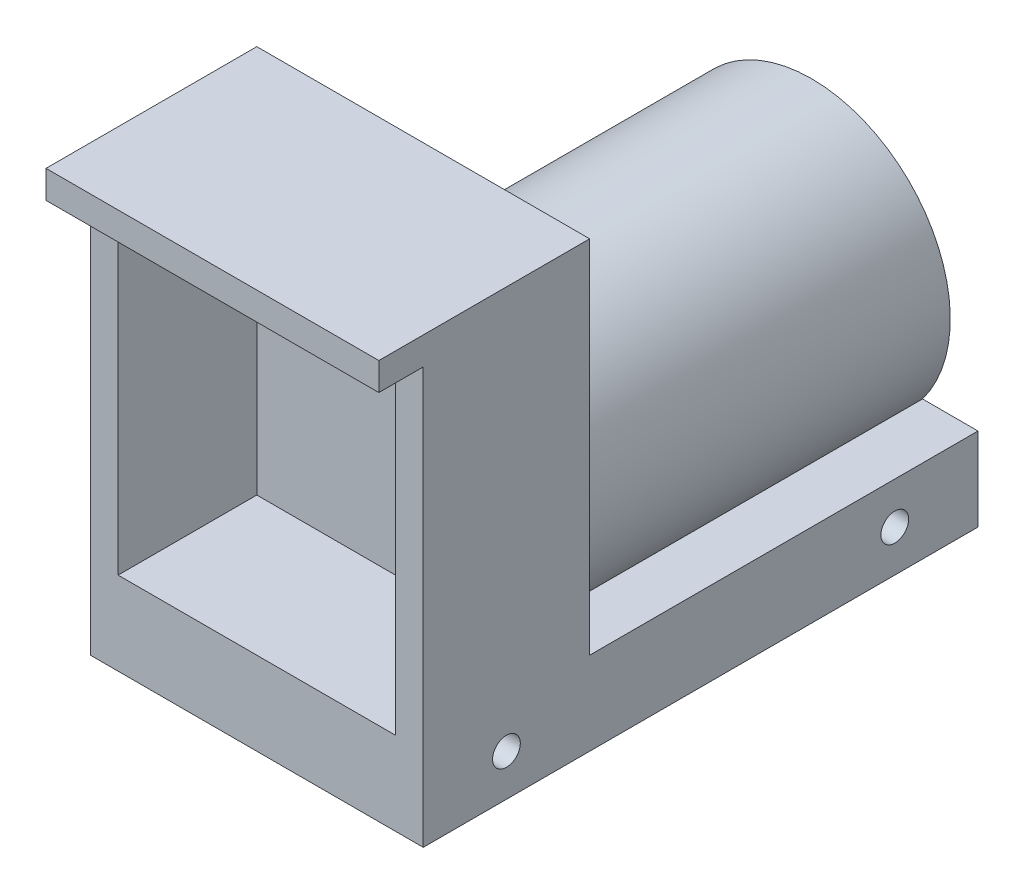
SolidWorks part; units mm, degrees
ref_plane "Front Plane" through (0, 0, 0) normal (0, 0, 1) x (1, 0, 0)
ref_plane "Top Plane" through (0, 0, 0) normal (0, 1, 0) x (1, 0, 0)
ref_plane "Right Plane" through (0, 0, 0) normal (1, 0, 0) x (0, 0, -1)
sketch "Sketch1" plane through (0, 0, 0) normal (1, 0, 0) x (0, 0, -1)
  line L0 (-50, 0) -> (50, 0)
  line L1 (50, 0) -> (50, 15)
  line L2 (50, 15) -> (-20, 15)
  line L3 (-20, 15) -> (-20, 80)
  line L4 (-20, 80) -> (-58, 80)
  line L5 (-58, 80) -> (-58, 75)
  line L6 (-58, 75) -> (-50, 75)
  line L7 (-50, 75) -> (-50, 0)
  dimension "D1" = 100
  dimension "D2" = 15
  dimension "D3" = 80
  dimension "D4" = 5
  dimension "D5" = 8
  dimension "D6" = 30
extrude "Boss-Extrude1" add sketch "Sketch1" along normal mid plane 60
sketch "Sketch2" plane through (0, 0, -50) normal (0, 0, -1) x (-1, 0, 0)
  line L0 (0, 0) -> (0, 30) construction
  circle A0 centre (0, 30) radius 25
  dimension "D1" = 50
  dimension "D2" = 30
extrude "Boss-Extrude2" add sketch "Sketch2" against normal up to surface (70 mm away)
sketch "Sketch3" plane through (0, 0, 50) normal (0, 0, 1) x (1, 0, 0)
  line L0 (30, 75) -> (-30, 75) construction
  line L1 (-25, 75) -> (25, 75)
  line L2 (-25, 75) -> (-25, 15)
  line L3 (-25, 15) -> (25, 15)
  line L4 (25, 75) -> (25, 15)
  line L5 (30, 15) -> (20, 15) construction
  line L6 (0, 0) -> (0, 15) construction
  line L8 (-30, 75) -> (-30, 0) construction
  dimension "D1" = 5
extrude "Cut-Extrude1" cut sketch "Sketch3" against normal offset from surface (25 mm away) 5
sketch "Sketch9" plane through (0, 0, 0) normal (1, 0, 0) x (0, 0, -1)
  line L0 (50, 0) -> (50, 15) construction
  line L1 (-50, 75) -> (-50, 0) construction
  line L2 (-50, 0) -> (50, 0) construction
  circle A0 centre (-35, 7.5) radius 2.5
  circle A1 centre (35, 7.5) radius 2.5
  point P5 (0, 0)
  dimension "D1" = 5
  dimension "D4" = 7.5
  dimension "D2" = 15
  dimension "D3" = 15
extrude "Cut-Extrude4" cut sketch "Sketch9" against normal through all both and the other way through all
